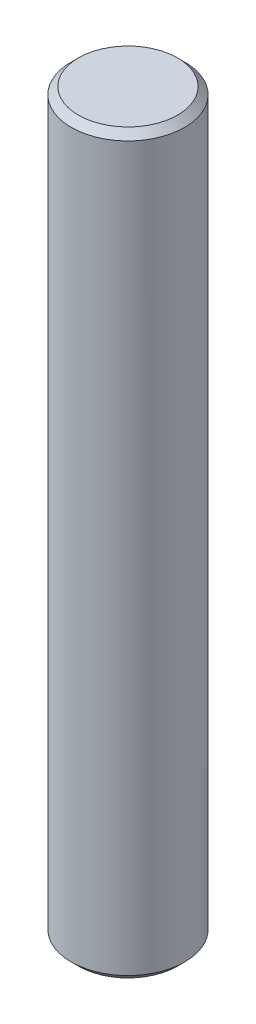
SolidWorks part; units mm, degrees
ref_plane "Plan1" through (0, 0, 0) normal (0, 0, 1) x (1, 0, 0)
ref_plane "Plan2" through (0, 0, 0) normal (0, 1, 0) x (1, 0, 0)
ref_plane "Plan3" through (0, 0, 0) normal (1, 0, 0) x (0, 0, -1)
sketch "Esquisse1" plane through (0, 0, 0) normal (0, 0, 1) x (1, 0, 0)
  line L0 (0, 26) -> (0, -99.4) construction
  line L1 (0, 26) -> (-4, 26)
  line L2 (0, 26) -> (0, -26)
  line L3 (0, -26) -> (-4, -26)
  line L4 (-4, 26) -> (-4, -26)
  dimension "D1" = 4
  dimension "D2" = 52
revolve "Base-Révolution" add sketch "Esquisse1" angle 360 about L0
chamfer "Chanfrein1" distance 0.5 angle 45
